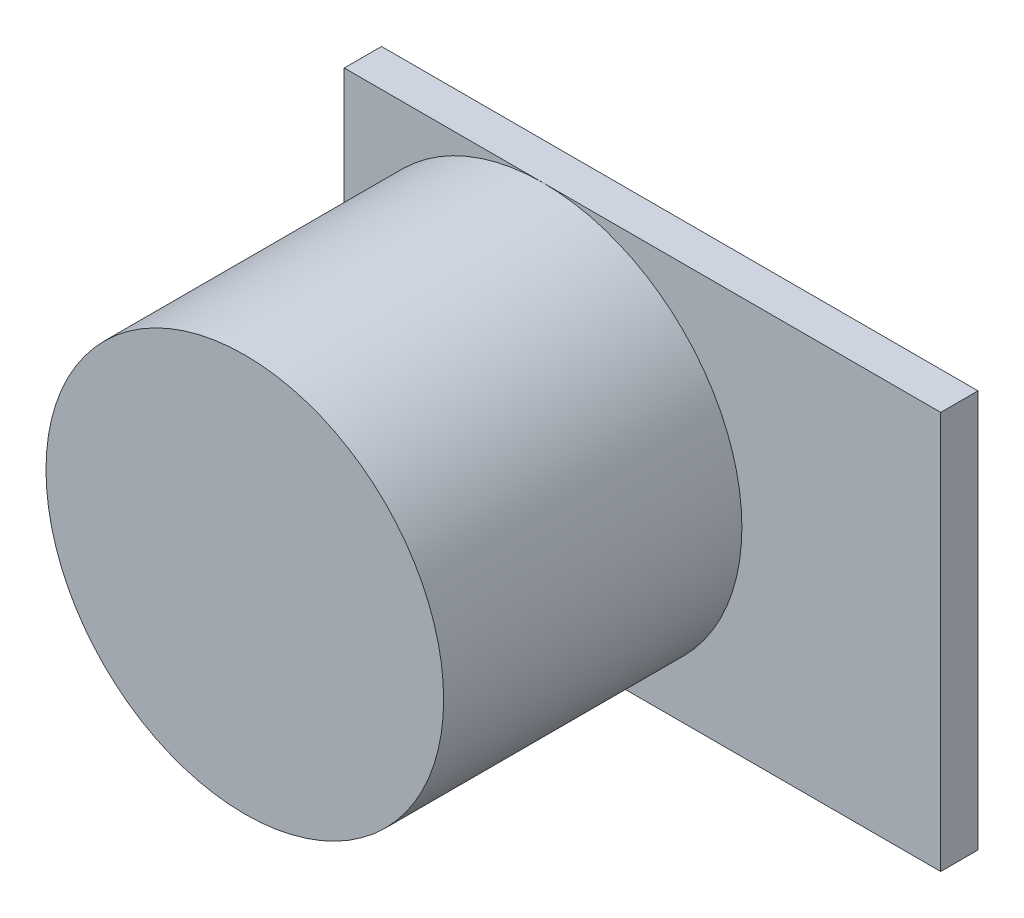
SolidWorks part; units mm, degrees
ref_plane "Vorne" through (0, 0, 0) normal (0, 0, 1) x (1, 0, 0)
ref_plane "Oben" through (0, 0, 0) normal (0, 1, 0) x (1, 0, 0)
ref_plane "Links" through (0, 0, 0) normal (1, 0, 0) x (0, 0, -1)
sketch "Skizze1" plane through (0, 0, 0) normal (0, 0, 1) x (1, 0, 0)
  circle A0 centre (0, 0) radius 80
  dimension "D1" = 160
extrude "Linear austragen1" add sketch "Skizze1" along normal blind 120
sketch "Skizze2" plane through (0, 0, 0) normal (0, 0, -1) x (-1, 0, 0)
  line L0 (80, 80) -> (80, -80)
  line L1 (80, 80) -> (-160, 80)
  line L2 (80, 0) -> (80, -80)
  line L3 (80, -80) -> (-160, -80)
  line L4 (-160, 80) -> (-160, -80)
  circle A1 centre (0, 0) radius 80 construction
  dimension "D1" = 240
extrude "Linear austragen2" add sketch "Skizze2" along normal blind 15
